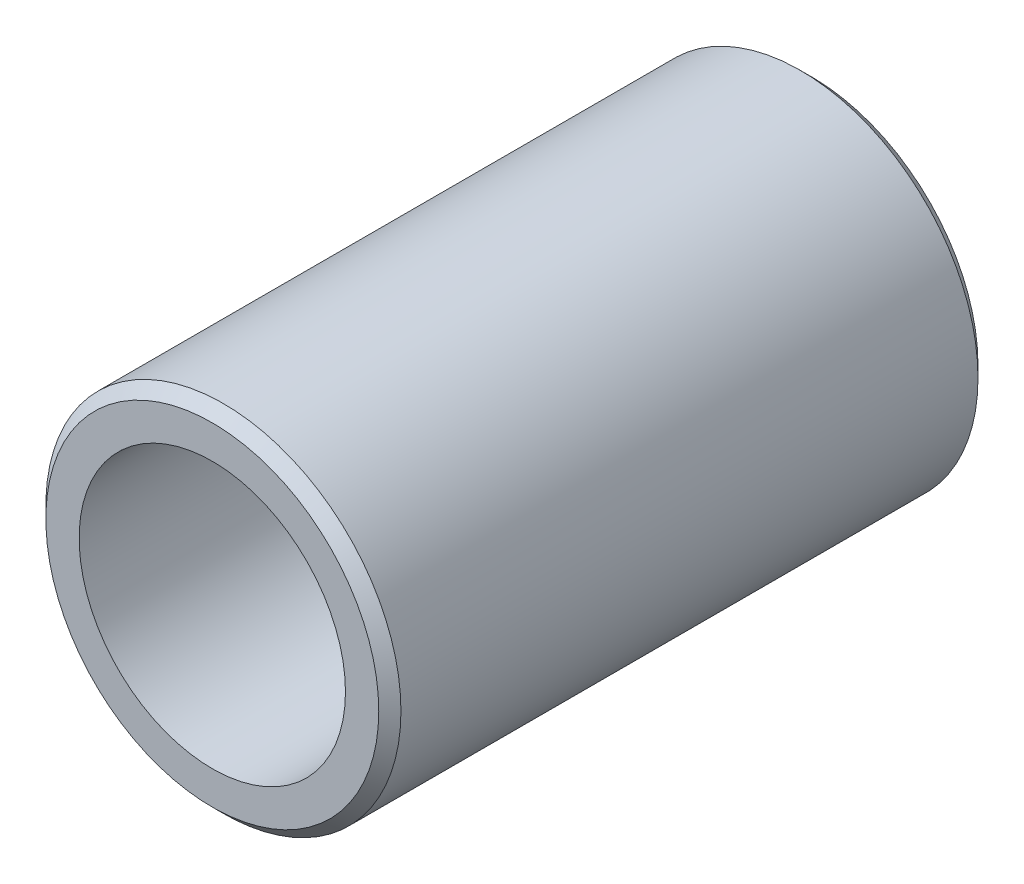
SolidWorks part; units mm, degrees
ref_plane "Plan de face" through (0, 0, 0) normal (0, 0, 1) x (1, 0, 0)
ref_plane "Plan de dessus" through (0, 0, 0) normal (0, 1, 0) x (1, 0, 0)
ref_plane "Plan de droite" through (0, 0, 0) normal (1, 0, 0) x (0, 0, -1)
sketch "Esquisse1" plane through (0, 0, 0) normal (0, 0, 1) x (1, 0, 0)
  circle A0 centre (0, 0) radius 8
  circle A1 centre (0, 0) radius 6
  dimension "D1" = 12
  dimension "D2" = 16
extrude "Extrusion1" add sketch "Esquisse1" along normal blind 27
chamfer "Chanfrein1" distance 0.5 angle 45 2 edges at (8, 0, 0) (8, 0, 27)
